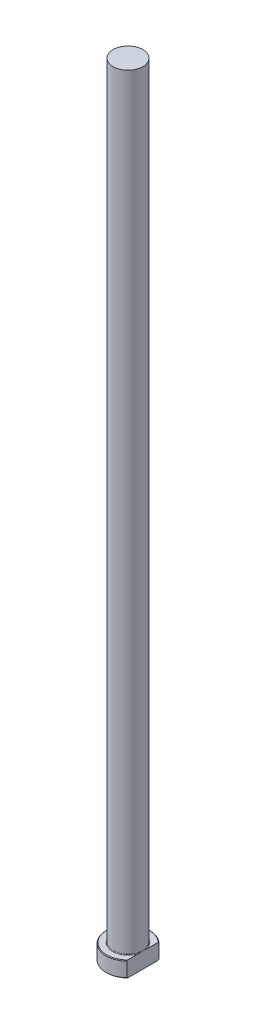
SolidWorks part; units mm, degrees
ref_plane "Front Plane" through (0, 0, 0) normal (0, 0, 1) x (1, 0, 0)
ref_plane "Top Plane" through (0, 0, 0) normal (0, 1, 0) x (1, 0, 0)
ref_plane "Right Plane" through (0, 0, 0) normal (1, 0, 0) x (0, 0, -1)
sketch "Sketch1" plane through (0, 0, 0) normal (0, 0, 1) x (1, 0, 0)
  line L0 (0, 259.9588) -> (0, -15.1925) construction
  line L1 (0, 0) -> (-7, 0)
  line L2 (-7, 0) -> (-7, 5)
  line L3 (-7, 5) -> (-4.75, 5)
  line L4 (-4.75, 5) -> (-4.75, 250)
  line L5 (-4.75, 250) -> (0, 250)
  line L6 (0, 250) -> (0, 0)
  dimension "L" = 250
  dimension "H" = 14
  dimension "T" = 5
  dimension "D" = 9.5
revolve "Revolve1" add sketch "Sketch1" angle 360 about L0
chamfer "Chamfer1" distance 0.2 angle 45 2 edges at (0, 5, 7) (0, 0, 7)
fillet "Fillet1" radius 0.2 1 edges at (0, 5, 4.75)
sketch "Sketch2" plane through (0, 0, 0) normal (0, 1, 0) x (1, 0, 0)
  line L0 (4.75, 5.1417) -> (4.75, -5.1417)
  circle A0 centre (0, 0) radius 7 construction
  arc A1 (4.75, -5.1417) -> (4.75, 5.1417) centre (0, 0) ccw
  circle A2 centre (0, 0) radius 4.75 construction
extrude "KEY" cut sketch "Sketch2" along normal through all
